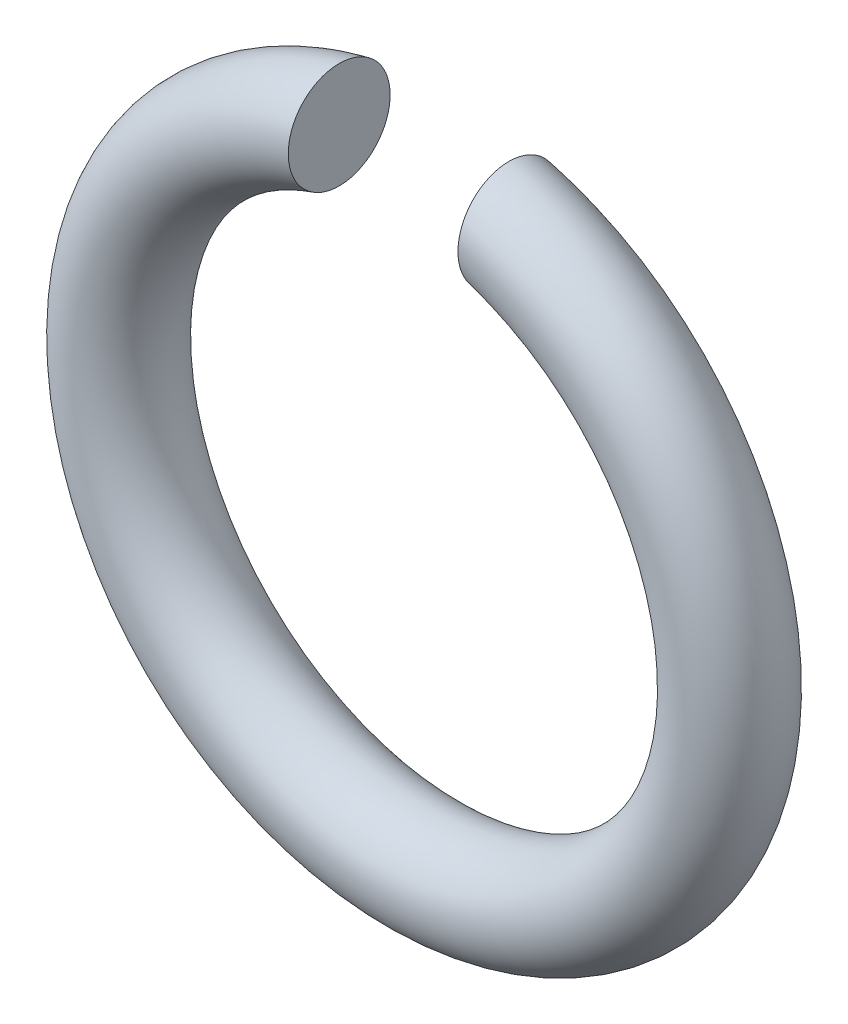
SolidWorks part; units mm, degrees
ref_plane "Front" through (0, 0, 0) normal (0, 0, 1) x (1, 0, 0)
ref_plane "Top" through (0, 0, 0) normal (0, 1, 0) x (1, 0, 0)
ref_plane "Right" through (0, 0, 0) normal (1, 0, 0) x (0, 0, -1)
other "Configuration Table"
sketch "Sketch1" plane through (0, 0, 0) normal (0, 0, 1) x (1, 0, 0)
  circle A1 centre (0, 0) radius 1.8
  dimension "D1" = 3.6
sketch "Sketch2" plane through (0, 0, 0) normal (0, 1, 0) x (1, 0, 0)
  circle A0 centre (1.8, 0) radius 0.3
  dimension "d1" = 0.6
sweep "Base-Sweep" add profiles "Sketch2" path "Sketch1"
sketch "Sketch3" plane through (0, 0, 0) normal (0, 0, 1) x (1, 0, 0)
  line L1 (-0.5, 0) -> (0.5, 0)
  line L2 (-0.5, 0) -> (-0.5, 2.1)
  line L3 (-0.5, 2.1) -> (0.5, 2.1)
  line L4 (0.5, 0) -> (0.5, 2.1)
extrude "Cut-Extrude1" cut sketch "Sketch3" against normal through all and the other way through all
equation "\"B/2@Sketch3\" = \"B@Sketch3\" / 2"
